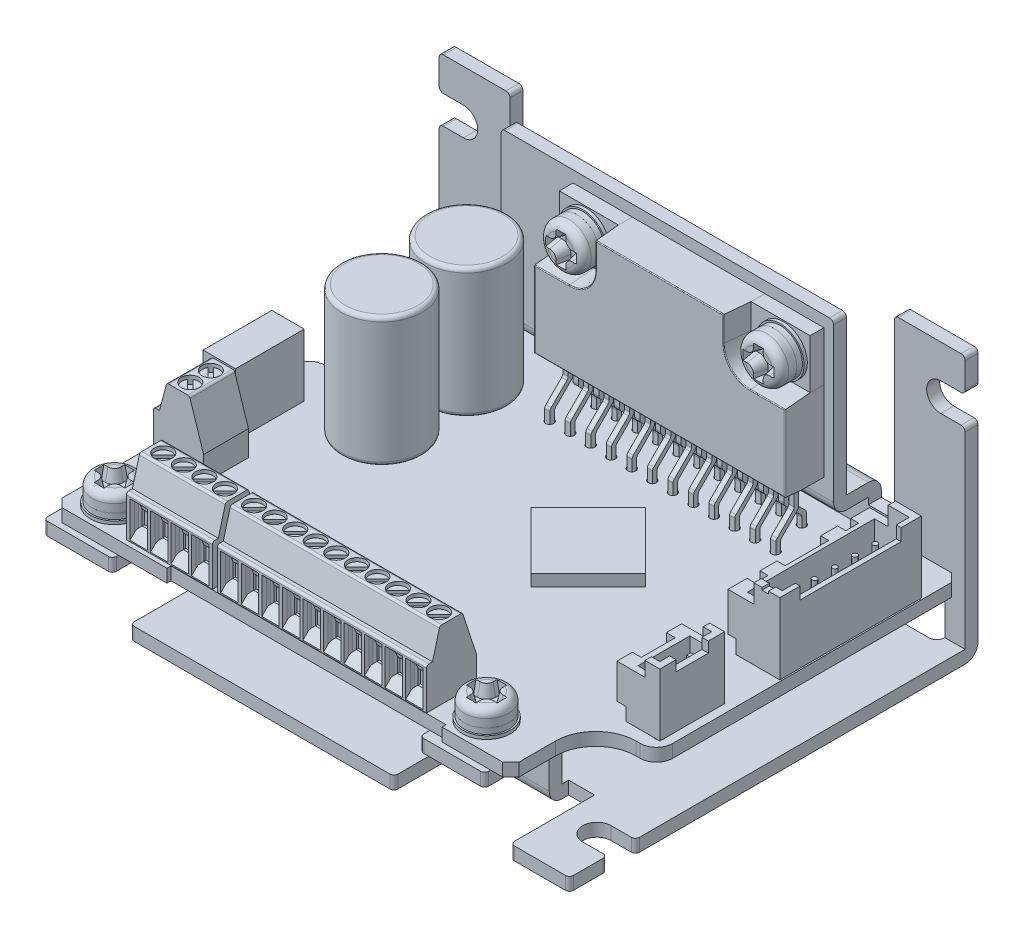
SolidWorks part; units mm, degrees
ref_plane "Front" through (0, 0, 0) normal (0, 0, 1) x (1, 0, 0)
ref_plane "Top" through (0, 0, 0) normal (0, 1, 0) x (1, 0, 0)
ref_plane "Right" through (0, 0, 0) normal (1, 0, 0) x (0, 0, -1)
imported_body "Imported3"
sketch "Sketch1" plane through (0, 0, -23.65) normal (0, 0, -1) x (-1, 0, 0)
  line L0 (17, 8.3) -> (17, 0)
  line L1 (17, 0) -> (-21, 0)
  line L2 (-21, 0) -> (-21, 8.3)
  line L3 (-21, 8.3) -> (17, 8.3)
extrude "Extrude1" add sketch "Sketch1" along normal blind 1.6
sketch "Sketch2" plane through (-17, 0, 0) normal (-1, 0, 0) x (0, 0, 1)
  line L0 (25.25, 0) -> (-22.65, 0)
  line L1 (-22.65, 0) -> (-22.65, 1.6)
  line L2 (-22.65, 1.6) -> (25.25, 1.6)
  line L3 (25.25, 1.6) -> (25.25, 0)
extrude "Extrude2" add sketch "Sketch2" along normal blind 12
sketch "Sketch3" plane through (-29, 0, 0) normal (-1, 0, 0) x (0, 0, 1)
  line L0 (-23.65, 8.3) -> (-23.65, 1.6)
  line L1 (-23.65, 1.6) -> (25.25, 1.6)
  line L2 (25.25, 1.6) -> (25.25, 0)
  line L3 (25.25, 0) -> (-25.25, 0)
  line L4 (-25.25, 0) -> (-25.25, 8.3)
  line L5 (-25.25, 8.3) -> (-23.65, 8.3)
extrude "Extrude3" add sketch "Sketch3" along normal blind 3.5
sketch "Sketch4" plane through (21, 0, 0) normal (1, 0, 0) x (0, 0, -1)
  line L0 (22.65, 0) -> (-25.25, 0)
  line L1 (-25.25, 0) -> (-25.25, 1.6)
  line L2 (-25.25, 1.6) -> (22.65, 1.6)
  line L3 (22.65, 1.6) -> (22.65, 0)
extrude "Extrude4" add sketch "Sketch4" along normal blind 11.5
sketch "Sketch5" plane through (0, 0, -22.65) normal (0, 0, -1) x (-1, 0, 0)
  line L0 (-32.5, 0) -> (-32.5, 1.6)
  line L1 (-32.5, 1.6) -> (-30, 1.6)
  line L2 (-30, 1.6) -> (-30, 0)
  line L3 (-30, 0) -> (-32.5, 0)
extrude "Extrude5" add sketch "Sketch5" along normal blind 1
sketch "Sketch6" plane through (0, 0, -23.65) normal (0, 0, -1) x (-1, 0, 0)
  line L0 (-30, 8.3) -> (-30, 0)
  line L1 (-30, 0) -> (-32.5, 0)
  line L2 (-32.5, 0) -> (-32.5, 8.3)
  line L3 (-32.5, 8.3) -> (-30, 8.3)
extrude "Extrude6" add sketch "Sketch6" along normal blind 1.6
sketch "Sketch7" plane through (0, 8.3, 0) normal (0, 1, 0) x (-1, 0, 0)
  line L0 (-32.5, -23.65) -> (32.5, -23.65)
  line L1 (32.5, -23.65) -> (32.5, -25.25)
  line L2 (32.5, -25.25) -> (-32.5, -25.25)
  line L3 (-32.5, -25.25) -> (-32.5, -23.65)
extrude "Extrude7" add sketch "Sketch7" along normal blind 24.7
sketch "Sketch8" plane through (0, 1.6, 0) normal (0, 1, 0) x (-1, 0, 0)
  line L0 (24, 14.85) -> (24, 25.25)
  line L1 (24, 25.25) -> (-32.5, 25.25)
  line L2 (-32.5, 25.25) -> (-32.5, 14.85)
  line L3 (-32.5, 14.85) -> (24, 14.85)
extrude "Extrude8" cut sketch "Sketch8" against normal through all
sketch "Sketch9" plane through (0, 1.6, 0) normal (0, 1, 0) x (-1, 0, 0)
  line L0 (24, 25.25) -> (32.5, 25.25)
  line L1 (32.5, 25.25) -> (32.5, 15.65)
  line L2 (32.5, 15.65) -> (24, 15.65)
  line L3 (24, 15.65) -> (24, 25.25)
extrude "Extrude9" add sketch "Sketch9" along normal blind 5.9
sketch "Sketch10" plane through (0, 8.3, 0) normal (0, -1, 0) x (1, 0, 0)
  line L0 (-26, -23.65) -> (-20, -23.65)
  line L1 (-20, -23.65) -> (-20, -25.25)
  line L2 (-20, -25.25) -> (-26, -25.25)
  line L3 (-26, -25.25) -> (-26, -23.65)
extrude "Extrude10" add sketch "Sketch10" along normal blind 2.4
sketch "Sketch11" plane through (0, 0, -23.65) normal (0, 0, 1) x (1, 0, 0)
  line L0 (-20, 5.9) -> (-26.5, 5.9)
  line L1 (-26.5, 5.9) -> (-26.5, 7.5)
  line L2 (-26.5, 7.5) -> (-20, 7.5)
  line L3 (-20, 7.5) -> (-20, 5.9)
extrude "Extrude11" add sketch "Sketch11" along normal blind 3.4
sketch "Sketch12" plane through (0, 0, 14.85) normal (0, 0, 1) x (1, 0, 0)
  line L0 (32.5, 0) -> (14, 0)
  line L1 (14, 0) -> (14, 1.6)
  line L2 (14, 1.6) -> (32.5, 1.6)
  line L3 (32.5, 1.6) -> (32.5, 0)
extrude "Extrude12" add sketch "Sketch12" along normal blind 10.4
sketch "Sketch13" plane through (0, 8.3, 0) normal (0, -1, 0) x (1, 0, 0)
  line L0 (27, -23.65) -> (27, -25.25)
  line L1 (27, -25.25) -> (24, -25.25)
  line L2 (24, -25.25) -> (24, -23.65)
  line L3 (24, -23.65) -> (27, -23.65)
extrude "Extrude13" add sketch "Sketch13" along normal blind 2.4
sketch "Sketch14" plane through (0, 0, -23.65) normal (0, 0, 1) x (1, 0, 0)
  line L0 (24, 7.5) -> (27, 7.5)
  line L1 (27, 7.5) -> (27, 5.9)
  line L2 (27, 5.9) -> (24, 5.9)
  line L3 (24, 5.9) -> (24, 7.5)
extrude "Extrude14" add sketch "Sketch14" along normal blind 3.4
sketch "Sketch15" plane through (0, 0, -25.25) normal (0, 0, -1) x (-1, 0, 0)
  line L0 (-20.55, 33) -> (-23.75, 33)
  line L1 (-23.75, 33) -> (-23.75, 11.1)
  line L2 (-23.75, 11.1) -> (-20.55, 11.1)
  line L3 (-20.55, 11.1) -> (-20.55, 33)
extrude "Extrude15" cut sketch "Sketch15" against normal through all
sketch "Sketch16" plane through (0, 0, -25.25) normal (0, 0, -1) x (-1, 0, 0)
  line L0 (20.55, 11.1) -> (32.5, 11.1)
  line L1 (32.5, 11.1) -> (32.5, 33)
  line L2 (32.5, 33) -> (20.55, 33)
  line L3 (20.55, 33) -> (20.55, 11.1)
extrude "Extrude16" cut sketch "Sketch16" against normal through all
sketch "Sketch17" plane through (0, 0, -23.65) normal (0, 0, 1) x (1, 0, 0)
  line L0 (20.55, 33) -> (20.55, 11.9)
  line L1 (20.55, 11.9) -> (-20.55, 11.9)
  line L2 (-20.55, 11.9) -> (-20.55, 33)
  line L3 (-20.55, 33) -> (20.55, 33)
extrude "Extrude17" add sketch "Sketch17" along normal blind 4.3
sketch "Sketch18" plane through (0, 11.1, 0) normal (0, 1, 0) x (-1, 0, 0)
  line L0 (23.75, -23.65) -> (32.5, -23.65)
  line L1 (32.5, -23.65) -> (32.5, -25.25)
  line L2 (32.5, -25.25) -> (23.75, -25.25)
  line L3 (23.75, -25.25) -> (23.75, -23.65)
extrude "Extrude18" add sketch "Sketch18" along normal blind 21.9
sketch "Sketch19" plane through (0, 1.6, 0) normal (0, 1, 0) x (-1, 0, 0)
  line L0 (-22, 25.25) -> (-25.2, 25.25)
  line L1 (-25.2, 25.25) -> (-25.2, 14.85)
  line L2 (-25.2, 14.85) -> (-22, 14.85)
  line L3 (-22, 14.85) -> (-22, 25.25)
extrude "Extrude19" cut sketch "Sketch19" against normal through all
sketch "Sketch20" plane through (0, 1.6, 0) normal (0, 1, 0) x (-1, 0, 0)
  line L0 (-14, 25.25) -> (-14, 15.65)
  line L1 (-14, 15.65) -> (-22, 15.65)
  line L2 (-22, 15.65) -> (-22, 25.25)
  line L3 (-22, 25.25) -> (-14, 25.25)
extrude "Extrude20" add sketch "Sketch20" along normal blind 5.9
sketch "Sketch21" plane through (0, 0, 14.85) normal (0, 0, 1) x (1, 0, 0)
  line L0 (10.8, 0) -> (-21.8, 0)
  line L1 (-21.8, 0) -> (-21.8, 1.6)
  line L2 (-21.8, 1.6) -> (10.8, 1.6)
  line L3 (10.8, 1.6) -> (10.8, 0)
extrude "Extrude21" add sketch "Sketch21" along normal blind 10.4
sketch "Sketch22" plane through (0, 0, -23.65) normal (0, 0, 1) x (1, 0, 0)
  line L0 (-32.5, 28.85) -> (-32.5, 25.35)
  line L1 (-32.5, 25.35) -> (-29.5, 25.35)
  line L2 (-29.5, 28.85) -> (-32.5, 28.85)
  arc A0 (-29.5, 25.35) -> (-29.5, 28.85) centre (-29.5, 27.1) ccw
extrude "Extrude22" cut sketch "Sketch22" against normal through all
sketch "Sketch23" plane through (0, 0, -23.65) normal (0, 0, 1) x (1, 0, 0)
  line L0 (32.5, 25.35) -> (32.5, 28.85)
  line L1 (32.5, 28.85) -> (29.5, 28.85)
  line L2 (29.5, 25.35) -> (32.5, 25.35)
  arc A0 (29.5, 28.85) -> (29.5, 25.35) centre (29.5, 27.1) ccw
extrude "Extrude23" cut sketch "Sketch23" against normal through all
sketch "Sketch24" plane through (0, 1.6, 0) normal (0, 1, 0) x (-1, 0, 0)
  line L0 (-32.5, 20.6) -> (-32.5, 17.1)
  line L1 (-32.5, 17.1) -> (-29.5, 17.1)
  line L2 (-29.5, 20.6) -> (-32.5, 20.6)
  arc A0 (-29.5, 17.1) -> (-29.5, 20.6) centre (-29.5, 18.85) ccw
extrude "Extrude24" cut sketch "Sketch24" against normal through all
sketch "Sketch25" plane through (-24, 0, 0) normal (1, 0, 0) x (0, 0, -1)
  line L0 (-17.25, 0) -> (-17.25, 5.9)
  line L1 (-17.25, 5.9) -> (-25.25, 5.9)
  line L2 (-25.25, 5.9) -> (-25.25, 0)
  line L3 (-25.25, 0) -> (-17.25, 0)
extrude "Extrude25" cut sketch "Sketch25" against normal through all
sketch "Sketch26" plane through (22, 0, 0) normal (1, 0, 0) x (0, 0, -1)
  line L0 (-17.25, 0) -> (-17.25, 5.9)
  line L1 (-17.25, 5.9) -> (-25.25, 5.9)
  line L2 (-25.25, 5.9) -> (-25.25, 0)
  line L3 (-25.25, 0) -> (-17.25, 0)
extrude "Extrude26" cut sketch "Sketch26" against normal up to next
sketch "Sketch27" plane through (0, 0, 0) normal (0, -1, 0) x (1, 0, 0)
  line L0 (-32.5, -10.4) -> (-32.5, -13.9)
  line L1 (-32.5, -13.9) -> (-29.5, -13.9)
  line L2 (-29.5, -10.4) -> (-32.5, -10.4)
  arc A0 (-29.5, -13.9) -> (-29.5, -10.4) centre (-29.5, -12.15) ccw
extrude "Extrude27" cut sketch "Sketch27" against normal through all
sketch "Sketch28" plane through (-20.55, 0, 0) normal (-1, 0, 0) x (0, 0, 1)
  line L0 (-25.25, 13.5) -> (-20.95, 13.5)
  line L1 (-20.95, 13.5) -> (-20.95, 33)
  line L2 (-20.95, 33) -> (-25.25, 33)
  line L3 (-25.25, 33) -> (-25.25, 13.5)
extrude "Extrude28" cut sketch "Sketch28" against normal up to next
sketch "Sketch29" plane through (0, 0, 0) normal (0, -1, 0) x (1, 0, 0)
  line L0 (-15, 3.75) -> (-15, -20.25)
  line L1 (-15, -20.25) -> (19.5, -20.25)
  line L2 (19.5, -20.25) -> (19.5, 3.75)
  line L3 (19.5, 3.75) -> (-15, 3.75)
extrude "Extrude29" cut sketch "Sketch29" against normal up to next
hole_wizard "HoleWzd1" positions "Sketch31" profile "Sketch30" hole size "Ø3.0" standard "Ansi Metric"
sketch "Sketch31" plane through (0, 0, -20.95) normal (0, 0, -1) x (-1, 0, 0)
  point P0 (-16.65, 21)
  point P1 (8.95, 21)
  point P2 (8.35, 28.5)
  point P3 (-16.05, 28.5)
sketch "Sketch30" plane through (16.65, 21, -20.95) normal (1, 0, 0) x (0, 1, 0)
  line L0 (0, 0) -> (0, 46.2)
  line L1 (0, 46.2) -> (1.5, 46.2)
  line L2 (1.5, 46.2) -> (1.5, 0)
  line L5 (1.5, 0) -> (0, 0)
  line L11 (0, -6.35) -> (0, 107.95) construction
  dimension "通し穴の直径" = 3
  dimension "通し穴の深さ" = 46.2
hole_wizard "HoleWzd2" positions "Sketch33" profile "Sketch32" hole size "Ø3.0" standard "Ansi Metric"
sketch "Sketch33" plane through (0, 5.9, 0) normal (0, -1, 0) x (-1, 0, 0)
  point P0 (28, -21)
  point P1 (-18, -21)
sketch "Sketch32" plane through (-28, 5.9, 21) normal (1, 0, 0) x (0, 0, -1)
  line L0 (0, 0) -> (0, 27.1)
  line L1 (0, 27.1) -> (1.5, 27.1)
  line L2 (1.5, 27.1) -> (1.5, 0)
  line L5 (1.5, 0) -> (0, 0)
  line L11 (0, -6.35) -> (0, 107.95) construction
  dimension "通し穴の直径" = 3
  dimension "通し穴の深さ" = 27.1
fillet "Fillet1" radius 0.5 26 edges at (32.5, 33, -24.45) (-20, 6.7, -20.25) (-26.5, 6.7, -20.25) (32.5, 0.8, 25.25) (14, 6.7, 25.25) (24, 6.7, -20.25) (27, 6.7, -20.25) (23.75, 33, -24.45) (20.55, 33, -20.15) (-20.55, 33, -20.15) (-23.75, 33, -24.45) (-32.5, 33, -24.45) (25.2, 0.8, 25.25) (10.8, 0.8, 25.25) (-21.8, 0.8, 25.25) (-32.5, 28.85, -24.45) (-32.5, 25.35, -24.45) (32.5, 25.35, -24.45) (32.5, 28.85, -24.45) (32.5, 0.8, 20.6) (32.5, 0.8, 17.1) (-24, 6.7, 25.25) (-32.5, 6.7, 25.25) (22, 6.7, 25.25) (-32.5, 0.8, -13.9) (-32.5, 0.8, -10.4)
fillet "Fillet2" radius 1 6 edges at (-29, 0.8, -22.65) (21, 0.8, -22.65) (30, 0.8, -22.65) (19.5, 0.8, 3.75) (-17, 0.8, -22.65) (-15, 0.8, 3.75)
fillet "Fillet3" radius 1.6 11 edges at (-23, 5.9, -25.25) (0, 11.9, -19.35) (31.25, 0, -25.25) (-28.25, 0, 17.25) (18, 7.5, 15.65) (18, 0, 17.25) (25.5, 5.9, -25.25) (-30.75, 0, -25.25) (0, 13.5, -25.25) (2, 0, -25.25) (-28.25, 7.5, 15.65)
fillet "Fillet4" radius 3 2 edges at (19.5, 0.8, -20.25) (-15, 0.8, -20.25)
imported_body "Imported4"
imported_body "Imported5"
imported_body "Imported6"
imported_body "Imported7"
imported_body "Imported8"
imported_body "Imported9"
imported_body "Imported10"
imported_body "Imported11"
imported_body "Imported12"
imported_body "Imported13"
imported_body "Imported14"
imported_body "Imported15"
imported_body "Imported16"
imported_body "Imported17"
imported_body "Imported18"
imported_body "Imported19"
imported_body "Imported20"
imported_body "Imported21"
imported_body "Imported22"
imported_body "Imported23"
imported_body "Imported24"
imported_body "Imported25"
imported_body "Imported26"
imported_body "Imported27"
imported_body "Imported28"
